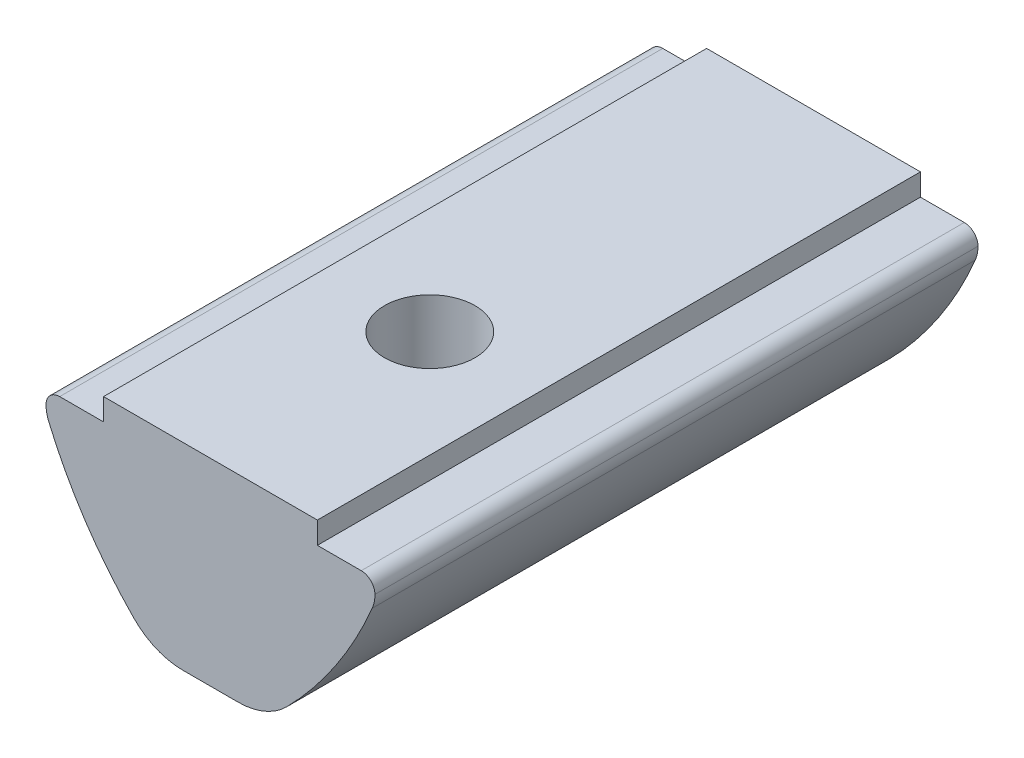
SolidWorks part; units mm, degrees
ref_plane "Ebene vorne" through (0, 0, 0) normal (0, 0, 1) x (1, 0, 0)
ref_plane "Ebene oben" through (0, 0, 0) normal (0, 1, 0) x (1, 0, 0)
ref_plane "Ebene rechts" through (0, 0, 0) normal (1, 0, 0) x (0, 0, -1)
imported_body "Importiert3"
sketch "Skizze1" plane through (0, -0.8, 0) normal (0, 1, 0) x (-1, 0, 0)
  line L0 (3.9, 0) -> (-3.9, 0)
  line L1 (-3.9, 0) -> (-3.9, 22)
  line L2 (3.9, 22) -> (3.9, 0)
  line L3 (-5.8956, 22) -> (5.8956, 22) construction
  line L4 (-3.9, 22) -> (3.9, 22)
  point P7 (0, 0)
  dimension "D1" = 7.8
extrude "Aufsatz-Linear austragen1" add sketch "Skizze1" along normal blind 0.8
ref_plane "Ebene1" through (0, 0, 5) normal (0, 0, 1) x (1, 0, 0)
sketch "Skizze3" plane through (0, 0, 5) normal (0, 0, 1) x (1, 0, 0)
  line L0 (2.5, -1.2) -> (0, -1.2)
  line L1 (0, -1.2) -> (0, -7.2)
  line L2 (0, -7.2) -> (2.5, -7.2)
  line L3 (2.5, -7.2) -> (2.5, -1.2)
  line L4 (0, -1.2) -> (0, -7.2) construction
revolve "Schnitt-Rotation1" cut sketch "Skizze3" angle 360 about L4
hole_wizard "M4 Gewindebohrung1" positions "Skizze5" profile "Skizze4" tap size "M4" standard "DIN"
sketch "Skizze5" plane through (0, 0, 0) normal (0, 1, 0) x (1, 0, 0)
  point P0 (0, -14)
sketch "Skizze4" plane through (0, 0, 14) normal (1, 0, 0) x (0, 0, 1)
  line L0 (0, 0) -> (0, 7.3567)
  line L1 (0, 7.3567) -> (1.65, 7.3567)
  line L2 (1.65, 7.3567) -> (1.65, 0)
  line L5 (1.65, 0) -> (0, 0)
  line L11 (0, -6.35) -> (0, 107.95) construction
  dimension "Nenndurchmesser (Haupt)" = 3.3
  dimension "Bohrungstiefe" = 7.3567
fillet "Verrundung2" radius 0.5 2 edges at (-5.8956, -0.8, 11) (5.8956, -0.8, 11)
fillet "Verrundung3" radius 2.5 3 edges at (2, -7.2, 14.25) (2, -7.2, 1.75) (-2, -7.2, 14.25)
